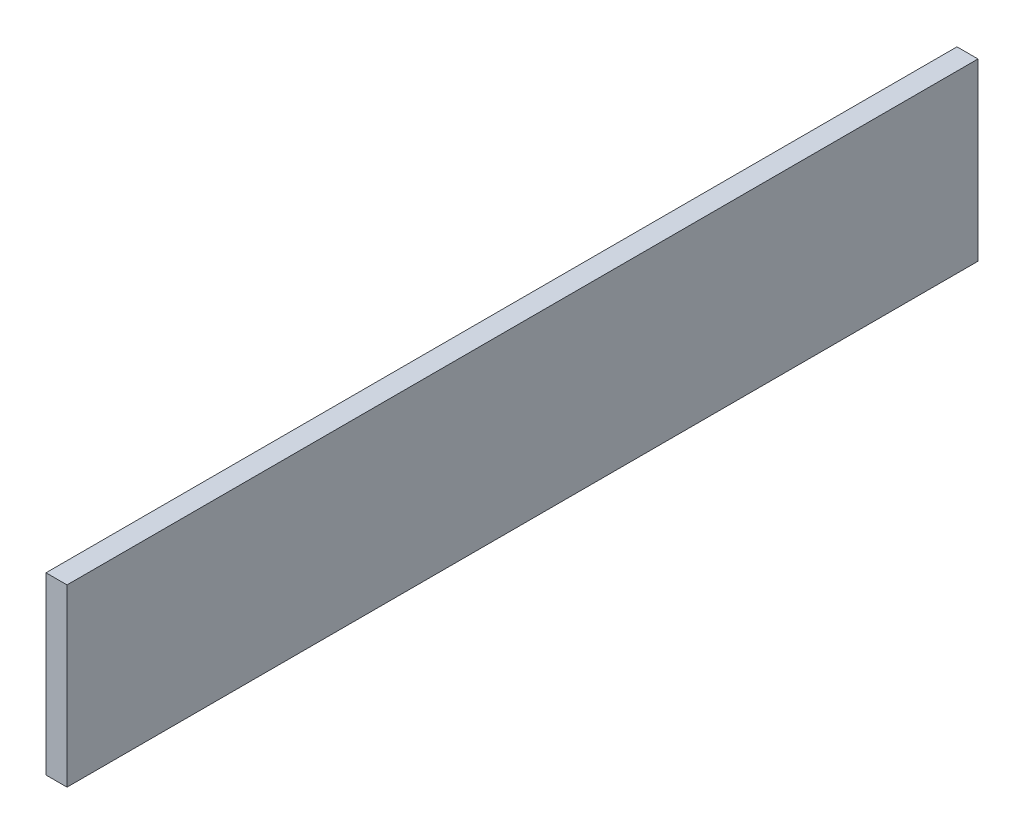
SolidWorks part; units mm, degrees
ref_plane "Plan de face" through (0, 0, 0) normal (0, 0, 1) x (1, 0, 0)
ref_plane "Plan de dessus" through (0, 0, 0) normal (0, 1, 0) x (1, 0, 0)
ref_plane "Plan de droite" through (0, 0, 0) normal (1, 0, 0) x (0, 0, -1)
sketch "Esquisse1" plane through (0, 0, 0) normal (0, 0, 1) x (1, 0, 0)
  line L1 (1.5, 120) -> (-1.5, 120)
  line L2 (1.5, 120) -> (1.5, 95)
  line L3 (1.5, 95) -> (-1.5, 95)
  line L4 (-1.5, 120) -> (-1.5, 95)
extrude "Boss.-Extru.1" add sketch "Esquisse1" against normal blind 120 and the other way blind 10
